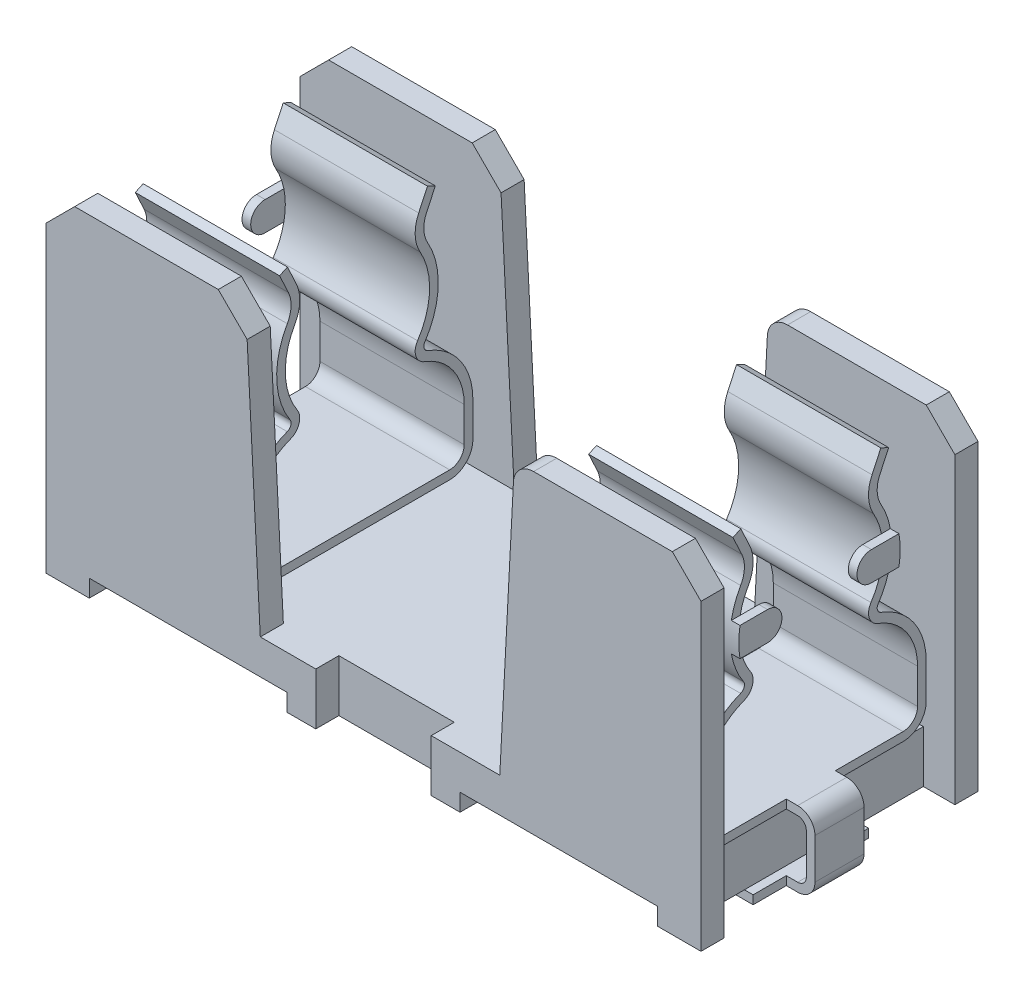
SolidWorks part; units mm, degrees
ref_plane "Front" through (0, 0, 0) normal (0, 0, 1) x (1, 0, 0)
ref_plane "Top" through (0, 0, 0) normal (0, 1, 0) x (1, 0, 0)
ref_plane "Right" through (0, 0, 0) normal (1, 0, 0) x (0, 0, -1)
imported_body "Импортированный1"
sketch "Эскиз1" plane through (10.356, 0, 0) normal (1, 0, 0) x (0, 0, -1)
  line L1 (-4, 2.3) -> (4, 2.3)
  line L2 (-4, 2.3) -> (-4, 0.5)
  line L3 (-4, 0.5) -> (4, 0.5)
  line L4 (4, 2.3) -> (4, 0.5)
extrude "Вытянуть1" cut sketch "Эскиз1" against normal blind 0.1
sketch "Эскиз2" plane through (-10.356, 0, 0) normal (-1, 0, 0) x (0, 0, 1)
  line L1 (-4, 2.3) -> (4, 2.3)
  line L2 (-4, 2.3) -> (-4, 0.5)
  line L3 (-4, 0.5) -> (4, 0.5)
  line L4 (4, 2.3) -> (4, 0.5)
extrude "Вытянуть2" cut sketch "Эскиз2" against normal blind 0.1
